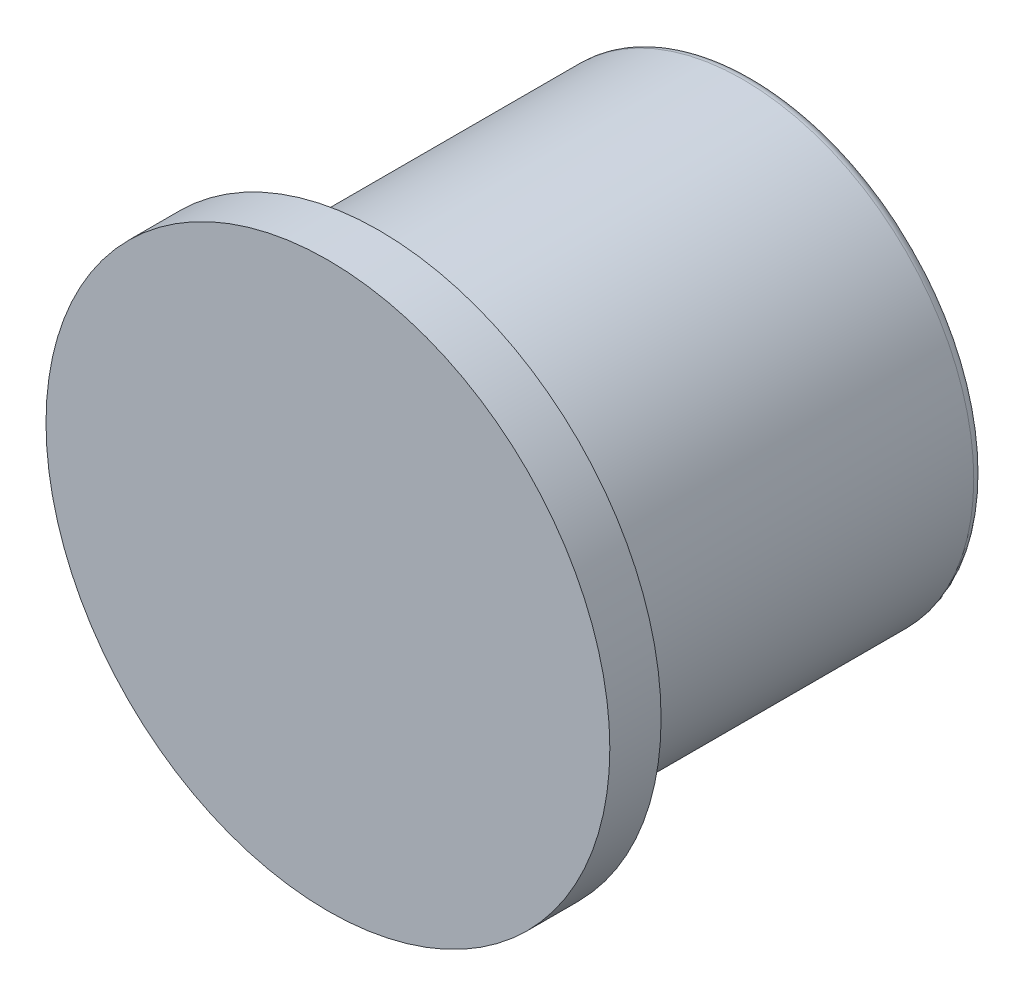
SolidWorks part; units mm, degrees
ref_plane "Front Plane" through (0, 0, 0) normal (0, 0, 1) x (1, 0, 0)
ref_plane "Top Plane" through (0, 0, 0) normal (0, 1, 0) x (1, 0, 0)
ref_plane "Right Plane" through (0, 0, 0) normal (1, 0, 0) x (0, 0, -1)
sketch "Sketch1" plane through (0, 0, 0) normal (1, 0, 0) x (0, 0, -1)
  line L0 (0, 0) -> (83, 0) construction
  line L1 (83, 0) -> (83, 43)
  line L2 (81, 45) -> (10, 45)
  line L3 (10, 45) -> (10, 55)
  line L4 (10, 55) -> (0, 55)
  line L5 (0, 55) -> (0, 0)
  line L6 (0, 0) -> (83, 0)
  arc A0 (83, 43) -> (81, 45) centre (81, 43) ccw
  dimension "D5" = 2
  dimension "D1" = 90
  dimension "D2" = 110
  dimension "D3" = 10
  dimension "D4" = 73
revolve "Revolve1" add sketch "Sketch1" angle 360 about L0
hole_wizard "M8 Tapped Hole1" positions "Sketch4" profile "Sketch3" tap size "M8" standard "ISO"
sketch "Sketch4" plane through (0, 0, -83) normal (0, 0, -1) x (-1, 0, 0)
  point P0 (0, 0)
sketch "Sketch3" plane through (0, 0, -83) normal (1, 0, 0) x (0, 1, 0)
  line L0 (0, 0) -> (0, 21.7929)
  line L1 (0, 21.7929) -> (3.4, 19.75)
  line L2 (3.4, 19.75) -> (3.4, 1.1)
  line L3 (3.4, 1.1) -> (4.5, 0)
  line L5 (4.5, 0) -> (0, 0)
  line L6 (-3.4, 1.1) -> (-4.5, 0) construction
  line L10 (0, 21.7929) -> (-3.4, 19.75) construction
  line L11 (0, -6.35) -> (0, 107.95) construction
  dimension "Tap Drill Dia." = 6.8
  dimension "Tap Drill Depth" = 19.75
  dimension "Near C'Sink Dia." = 9
  dimension "Near C'Sink Angle" = 90
  dimension "Drill Angle" = 118
